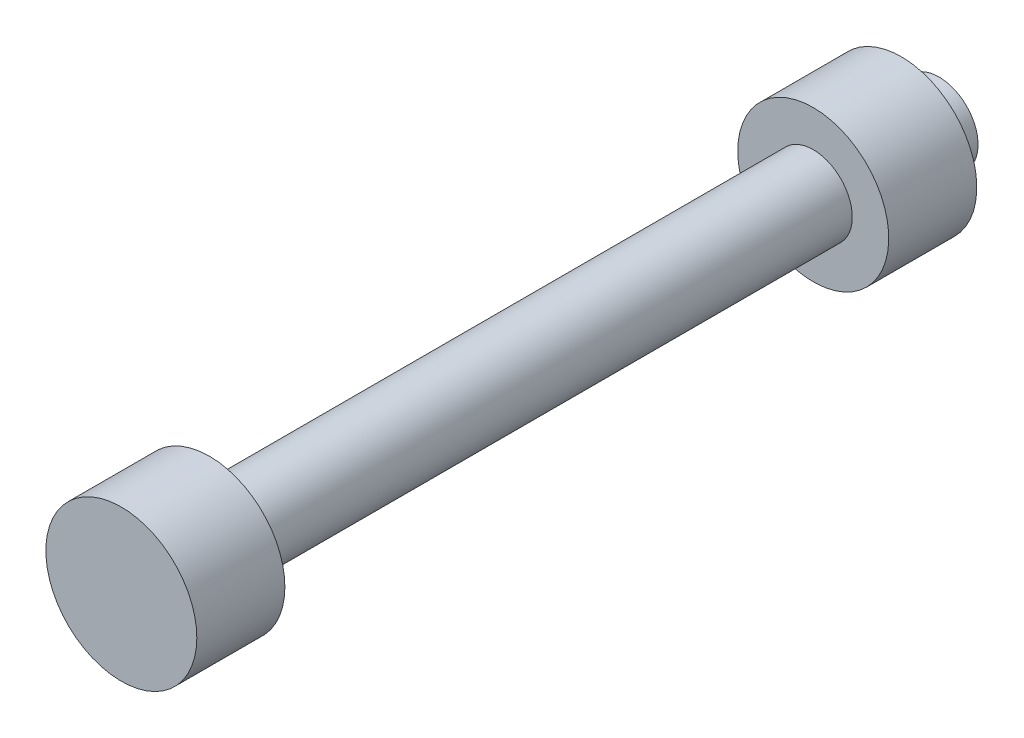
SolidWorks part; units mm, degrees
ref_plane "Front Plane" through (0, 0, 0) normal (0, 0, 1) x (1, 0, 0)
ref_plane "Top Plane" through (0, 0, 0) normal (0, 1, 0) x (1, 0, 0)
ref_plane "Right Plane" through (0, 0, 0) normal (1, 0, 0) x (0, 0, -1)
sketch "Sketch1" plane through (0, 0, 0) normal (0, 0, 1) x (1, 0, 0)
  circle A0 centre (0, 0) radius 9.525
  arc A1 (4.7625, 8.2489) -> (-4.7625, 8.2489) centre (0, 0) ccw construction
extrude "Boss-Extrude1" add sketch "Sketch1" against normal up to surface (11.1125 mm away)
sketch "Sketch2" plane through (0, 0, -11.1125) normal (0, 0, -1) x (-1, 0, 0)
  circle A0 centre (0, 0) radius 4.9238
  dimension "D1" = 9.8476
extrude "Boss-Extrude2" add sketch "Sketch2" along normal up to surface (92.075 mm away)
ref_plane "Plane1" through (0, 0, -87.3125) normal (0, 0, -1) x (-1, 0, 0)
sketch "Sketch3" plane through (0, 0, -87.3125) normal (0, 0, -1) x (-1, 0, 0)
  circle A0 centre (0, 0) radius 9.525
  arc A1 (9.5105, -0.5247) -> (5.2096, 7.974) centre (0, 0) ccw construction
extrude "Boss-Extrude3" add sketch "Sketch3" along normal up to surface (11.1125 mm away)
